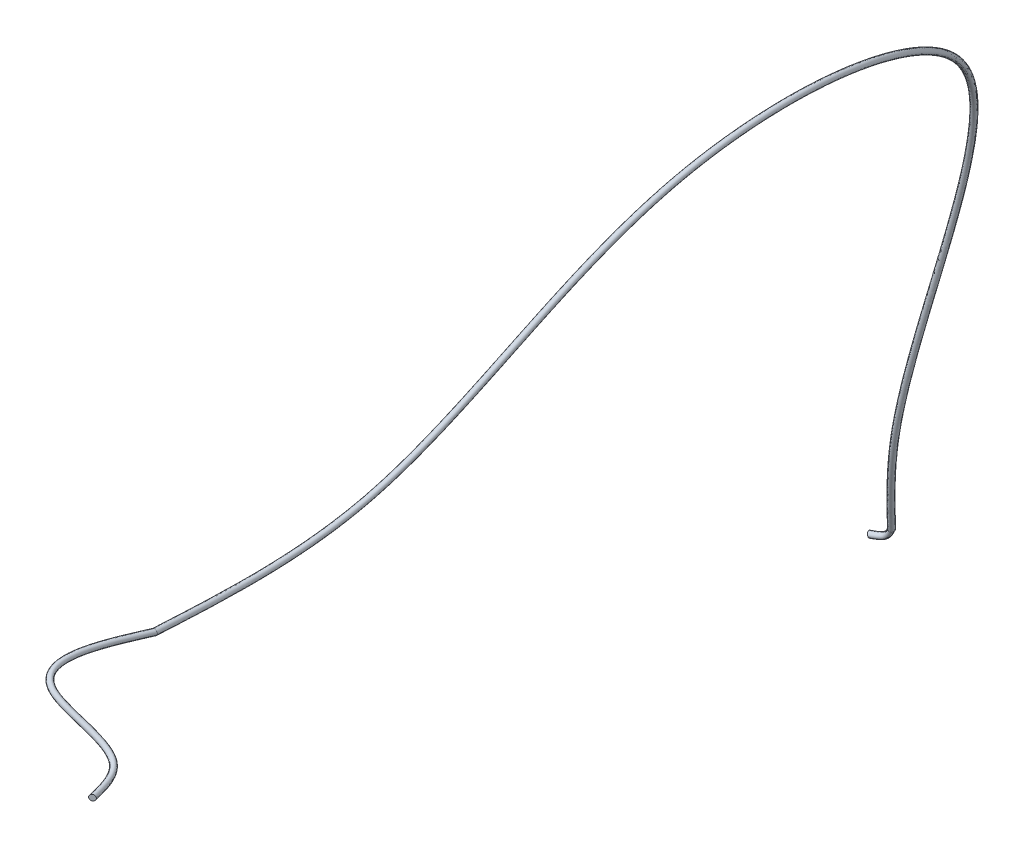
SolidWorks part; units mm, degrees
ref_plane "Plan de face" through (0, 0, 0) normal (0, 0, 1) x (1, 0, 0)
ref_plane "Plan de dessus" through (0, 0, 0) normal (0, 1, 0) x (1, 0, 0)
ref_plane "Plan de droite" through (0, 0, 0) normal (1, 0, 0) x (0, 0, -1)
sketch "Esquisse2" plane through (0, 0, -32.8401) normal (0, 0, 1) x (1, 0, 0)
  circle A0 centre (-0.4961, 22.0386) radius 0.4308
sketch "Esquisse4" plane through (-5.1814, 1.3044, 0) normal (0.9697, -0.2441, 0) x (0, 0, -1)
  spline S0 degree 3 poles (32.8401, 21.224) (43.8196, 20.4369) (71.4416, 18.4567) (97.8332, 55.876) (166.3627, 47.4351) (149.3102, -6.0738) (155.9305, -31.0165) (157.3642, -36.4182) knots 0 0 0 0 0.155615 0.391493 0.609631 0.91546 1 1 1 1
sweep "Balayage1" add profiles "Esquisse2" path "Esquisse4"
sketch3d "Esquisse3D1"
  circle A1 centre (-14.5726, -33.877, -157.3894) radius 0.4308 construction
  spline S0 degree 3 poles (-14.5726, -33.877, -157.3894) (-14.8745, -34.4259, -157.4716) (-15.491, -35.5469, -157.6395) (-16.6637, -35.6023, -157.0918) (-17.2622, -35.6305, -156.8123) knots 0 0 0 0 0.489671 1 1 1 1
  point P4 (-14.672, -34.272, -157.5295)
sketch "Esquisse5" plane through (-19.7592, -78.4888, -27.814) normal (-0.2309, -0.9171, -0.325) x (0.973, -0.2176, -0.0771)
  circle A0 centre (5.3307, -137.0347) radius 0.4308
sweep "Balayage3" add profiles "Esquisse5" path "Esquisse3D1"
sketch3d "Esquisse3D2"
  spline S0 degree 3 poles (-0.4961, 22.0386, -32.8401) (-2.1651, 23.0566, -25.6864) (-4.9554, 24.7586, -13.7269) (9.0541, 16.7828, -20.4221) (10.6766, 16.9241, -14.1643) (11.2995, 16.9783, -11.762) knots 0 0 0 0 0.47838 0.799754 1 1 1 1
sketch "Esquisse6" plane through (0, 0, -32.8401) normal (0, 0, 1) x (1, 0, 0)
  circle A0 centre (-0.4961, 22.0386) radius 0.4308
sweep "Balayage4" add profiles "Esquisse6" path "Esquisse3D2"
